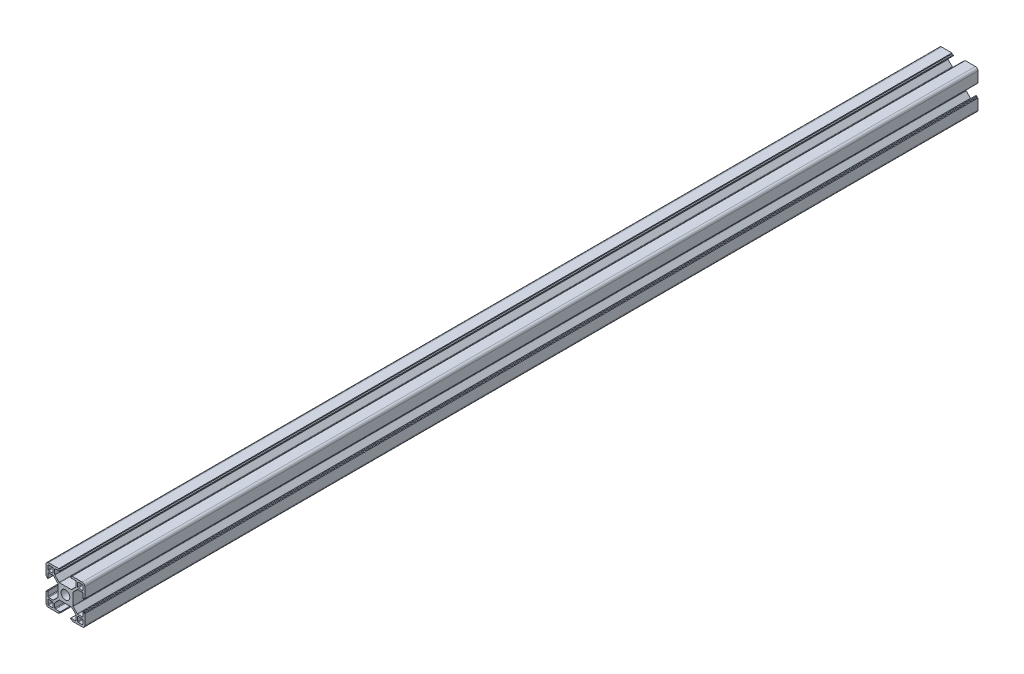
SolidWorks part; units mm, degrees
other "Body1"
ref_plane "Płaszczyzna przednia" through (0, 0, 0) normal (0, 0, 1) x (1, 0, 0)
ref_plane "Płaszczyzna górna" through (0, 0, 0) normal (0, 1, 0) x (1, 0, 0)
ref_plane "Płaszczyzna prawa" through (0, 0, 0) normal (1, 0, 0) x (0, 0, -1)
imported_body "Import1"
sketch "Szkic1" plane through (0, 0, 170) normal (0, 0, 1) x (1, 0, 0)
  line L4 (24.9798, 1.4394) -> (27.9798, 1.4394)
  line L5 (24.4798, 4.9394) -> (24.4798, 1.9394)
  line L6 (27.9798, 5.4394) -> (24.9798, 5.4394)
  line L7 (28.4798, 1.9394) -> (28.4798, 4.9394)
  line L8 (24.9798, 1.4394) -> (27.9798, 1.4394)
  line L9 (24.4798, 4.9394) -> (24.4798, 1.9394)
  line L10 (27.9798, 5.4394) -> (24.9798, 5.4394)
  line L11 (28.4798, 1.9394) -> (28.4798, 4.9394)
  line L12 (1.4798, 4.9394) -> (1.4798, 1.9394)
  line L13 (4.9798, 5.4394) -> (1.9798, 5.4394)
  line L14 (5.4798, 1.9394) -> (5.4798, 4.9394)
  line L15 (1.9798, 1.4394) -> (4.9798, 1.4394)
  line L16 (1.4798, 4.9394) -> (1.4798, 1.9394)
  line L17 (4.9798, 5.4394) -> (1.9798, 5.4394)
  line L18 (5.4798, 1.9394) -> (5.4798, 4.9394)
  line L19 (1.9798, 1.4394) -> (4.9798, 1.4394)
  line L20 (4.9798, 28.4394) -> (1.9798, 28.4394)
  line L21 (5.4798, 24.9394) -> (5.4798, 27.9394)
  line L22 (1.9798, 24.4394) -> (4.9798, 24.4394)
  line L23 (1.4798, 27.9394) -> (1.4798, 24.9394)
  line L24 (4.9798, 28.4394) -> (1.9798, 28.4394)
  line L25 (5.4798, 24.9394) -> (5.4798, 27.9394)
  line L26 (1.9798, 24.4394) -> (4.9798, 24.4394)
  line L27 (1.4798, 27.9394) -> (1.4798, 24.9394)
  line L28 (28.4798, 24.9394) -> (28.4798, 27.9394)
  line L29 (24.9798, 24.4394) -> (27.9798, 24.4394)
  line L30 (24.4798, 27.9394) -> (24.4798, 24.9394)
  line L31 (27.9798, 28.4394) -> (24.9798, 28.4394)
  line L32 (28.4798, 24.9394) -> (28.4798, 27.9394)
  line L33 (24.9798, 24.4394) -> (27.9798, 24.4394)
  line L34 (24.4798, 27.9394) -> (24.4798, 24.9394)
  line L35 (27.9798, 28.4394) -> (24.9798, 28.4394)
  line L60 (-0.0202, 9.8394) -> (-0.0202, 1.9394)
  line L61 (1.9798, -0.0606) -> (9.8798, -0.0606)
  line L62 (9.8798, -0.0606) -> (9.8798, 0.6894)
  line L63 (9.8798, 0.6894) -> (10.8798, 0.6894)
  line L64 (10.8798, 0.6894) -> (10.8798, 1.4394)
  line L65 (10.8798, 1.4394) -> (7.2298, 1.4394)
  line L66 (6.7298, 1.9394) -> (6.7298, 5.4216)
  line L67 (6.8762, 5.7752) -> (10.094, 8.9929)
  line L68 (10.4475, 9.1394) -> (19.512, 9.1394)
  line L69 (19.8656, 8.9929) -> (23.0833, 5.7752)
  line L70 (23.2298, 5.4216) -> (23.2298, 1.9394)
  line L71 (22.7298, 1.4394) -> (19.0798, 1.4394)
  line L72 (19.0798, 1.4394) -> (19.0798, 0.6894)
  line L73 (19.0798, 0.6894) -> (20.0798, 0.6894)
  line L74 (20.0798, 0.6894) -> (20.0798, -0.0606)
  line L75 (20.0798, -0.0606) -> (27.9798, -0.0606)
  line L76 (29.9798, 1.9394) -> (29.9798, 9.8394)
  line L77 (29.9798, 9.8394) -> (29.2298, 9.8394)
  line L78 (29.2298, 9.8394) -> (29.2298, 10.8394)
  line L79 (29.2298, 10.8394) -> (28.4798, 10.8394)
  line L80 (28.4798, 10.8394) -> (28.4798, 7.1894)
  line L81 (27.9798, 6.6894) -> (24.4975, 6.6894)
  line L82 (24.144, 6.8358) -> (20.9262, 10.0536)
  line L83 (20.7798, 10.4071) -> (20.7798, 19.4716)
  line L84 (20.9262, 19.8252) -> (24.144, 23.0429)
  line L85 (24.4975, 23.1894) -> (27.9798, 23.1894)
  line L86 (28.4798, 22.6894) -> (28.4798, 19.0394)
  line L87 (28.4798, 19.0394) -> (29.2298, 19.0394)
  line L88 (29.2298, 19.0394) -> (29.2298, 20.0394)
  line L89 (29.2298, 20.0394) -> (29.9798, 20.0394)
  line L90 (29.9798, 20.0394) -> (29.9798, 27.9394)
  line L91 (27.9798, 29.9394) -> (20.0798, 29.9394)
  line L92 (20.0798, 29.9394) -> (20.0798, 29.1894)
  line L93 (20.0798, 29.1894) -> (19.0798, 29.1894)
  line L94 (19.0798, 29.1894) -> (19.0798, 28.4394)
  line L95 (19.0798, 28.4394) -> (22.7298, 28.4394)
  line L96 (23.2298, 27.9394) -> (23.2298, 24.4571)
  line L97 (23.0833, 24.1036) -> (19.8656, 20.8858)
  line L98 (19.512, 20.7394) -> (10.4475, 20.7394)
  line L99 (10.094, 20.8858) -> (6.8762, 24.1036)
  line L100 (6.7298, 24.4571) -> (6.7298, 27.9394)
  line L101 (7.2298, 28.4394) -> (10.8798, 28.4394)
  line L102 (10.8798, 28.4394) -> (10.8798, 29.1894)
  line L103 (10.8798, 29.1894) -> (9.8798, 29.1894)
  line L104 (9.8798, 29.1894) -> (9.8798, 29.9394)
  line L105 (9.8798, 29.9394) -> (1.9798, 29.9394)
  line L106 (-0.0202, 27.9394) -> (-0.0202, 20.0394)
  line L107 (-0.0202, 20.0394) -> (0.7298, 20.0394)
  line L108 (0.7298, 20.0394) -> (0.7298, 19.0394)
  line L109 (0.7298, 19.0394) -> (1.4798, 19.0394)
  line L110 (1.4798, 19.0394) -> (1.4798, 22.6894)
  line L111 (1.9798, 23.1894) -> (5.462, 23.1894)
  line L112 (5.8156, 23.0429) -> (9.0333, 19.8252)
  line L113 (9.1798, 19.4716) -> (9.1798, 10.4071)
  line L114 (9.0333, 10.0536) -> (5.8156, 6.8358)
  line L115 (5.462, 6.6894) -> (1.9798, 6.6894)
  line L116 (1.4798, 7.1894) -> (1.4798, 10.8394)
  line L117 (1.4798, 10.8394) -> (0.7298, 10.8394)
  line L118 (0.7298, 10.8394) -> (0.7298, 9.8394)
  line L119 (0.7298, 9.8394) -> (-0.0202, 9.8394)
  line L120 (-0.0202, 9.8394) -> (-0.0202, 1.9394)
  line L121 (1.9798, -0.0606) -> (9.8798, -0.0606)
  line L122 (9.8798, -0.0606) -> (9.8798, 0.6894)
  line L123 (9.8798, 0.6894) -> (10.8798, 0.6894)
  line L124 (10.8798, 0.6894) -> (10.8798, 1.4394)
  line L125 (10.8798, 1.4394) -> (7.2298, 1.4394)
  line L126 (6.7298, 1.9394) -> (6.7298, 5.4216)
  line L127 (6.8762, 5.7752) -> (10.094, 8.9929)
  line L128 (10.4475, 9.1394) -> (19.512, 9.1394)
  line L129 (19.8656, 8.9929) -> (23.0833, 5.7752)
  line L130 (23.2298, 5.4216) -> (23.2298, 1.9394)
  line L131 (22.7298, 1.4394) -> (19.0798, 1.4394)
  line L132 (19.0798, 1.4394) -> (19.0798, 0.6894)
  line L133 (19.0798, 0.6894) -> (20.0798, 0.6894)
  line L134 (20.0798, 0.6894) -> (20.0798, -0.0606)
  line L135 (20.0798, -0.0606) -> (27.9798, -0.0606)
  line L136 (29.9798, 1.9394) -> (29.9798, 9.8394)
  line L137 (29.9798, 9.8394) -> (29.2298, 9.8394)
  line L138 (29.2298, 9.8394) -> (29.2298, 10.8394)
  line L139 (29.2298, 10.8394) -> (28.4798, 10.8394)
  line L140 (28.4798, 10.8394) -> (28.4798, 7.1894)
  line L141 (27.9798, 6.6894) -> (24.4975, 6.6894)
  line L142 (24.144, 6.8358) -> (20.9262, 10.0536)
  line L143 (20.7798, 10.4071) -> (20.7798, 19.4716)
  line L144 (20.9262, 19.8252) -> (24.144, 23.0429)
  line L145 (24.4975, 23.1894) -> (27.9798, 23.1894)
  line L146 (28.4798, 22.6894) -> (28.4798, 19.0394)
  line L147 (28.4798, 19.0394) -> (29.2298, 19.0394)
  line L148 (29.2298, 19.0394) -> (29.2298, 20.0394)
  line L149 (29.2298, 20.0394) -> (29.9798, 20.0394)
  line L150 (29.9798, 20.0394) -> (29.9798, 27.9394)
  line L151 (27.9798, 29.9394) -> (20.0798, 29.9394)
  line L152 (20.0798, 29.9394) -> (20.0798, 29.1894)
  line L153 (20.0798, 29.1894) -> (19.0798, 29.1894)
  line L154 (19.0798, 29.1894) -> (19.0798, 28.4394)
  line L155 (19.0798, 28.4394) -> (22.7298, 28.4394)
  line L156 (23.2298, 27.9394) -> (23.2298, 24.4571)
  line L157 (23.0833, 24.1036) -> (19.8656, 20.8858)
  line L158 (19.512, 20.7394) -> (10.4475, 20.7394)
  line L159 (10.094, 20.8858) -> (6.8762, 24.1036)
  line L160 (6.7298, 24.4571) -> (6.7298, 27.9394)
  line L161 (7.2298, 28.4394) -> (10.8798, 28.4394)
  line L162 (10.8798, 28.4394) -> (10.8798, 29.1894)
  line L163 (10.8798, 29.1894) -> (9.8798, 29.1894)
  line L164 (9.8798, 29.1894) -> (9.8798, 29.9394)
  line L165 (9.8798, 29.9394) -> (1.9798, 29.9394)
  line L166 (-0.0202, 27.9394) -> (-0.0202, 20.0394)
  line L167 (-0.0202, 20.0394) -> (0.7298, 20.0394)
  line L168 (0.7298, 20.0394) -> (0.7298, 19.0394)
  line L169 (0.7298, 19.0394) -> (1.4798, 19.0394)
  line L170 (1.4798, 19.0394) -> (1.4798, 22.6894)
  line L171 (1.9798, 23.1894) -> (5.462, 23.1894)
  line L172 (5.8156, 23.0429) -> (9.0333, 19.8252)
  line L173 (9.1798, 19.4716) -> (9.1798, 10.4071)
  line L174 (9.0333, 10.0536) -> (5.8156, 6.8358)
  line L175 (5.462, 6.6894) -> (1.9798, 6.6894)
  line L176 (1.4798, 7.1894) -> (1.4798, 10.8394)
  line L177 (1.4798, 10.8394) -> (0.7298, 10.8394)
  line L178 (0.7298, 10.8394) -> (0.7298, 9.8394)
  line L179 (0.7298, 9.8394) -> (-0.0202, 9.8394)
  circle A1 centre (14.9798, 14.9394) radius 3.4
  circle A2 centre (14.9798, 14.9394) radius 3.4
  arc A4 (27.9798, 1.4394) -> (28.4798, 1.9394) centre (27.9798, 1.9394) ccw
  arc A5 (24.4798, 1.9394) -> (24.9798, 1.4394) centre (24.9798, 1.9394) ccw
  arc A6 (24.9798, 5.4394) -> (24.4798, 4.9394) centre (24.9798, 4.9394) ccw
  arc A7 (28.4798, 4.9394) -> (27.9798, 5.4394) centre (27.9798, 4.9394) ccw
  arc A8 (27.9798, 1.4394) -> (28.4798, 1.9394) centre (27.9798, 1.9394) ccw
  arc A9 (24.4798, 1.9394) -> (24.9798, 1.4394) centre (24.9798, 1.9394) ccw
  arc A10 (24.9798, 5.4394) -> (24.4798, 4.9394) centre (24.9798, 4.9394) ccw
  arc A11 (28.4798, 4.9394) -> (27.9798, 5.4394) centre (27.9798, 4.9394) ccw
  arc A12 (1.4798, 1.9394) -> (1.9798, 1.4394) centre (1.9798, 1.9394) ccw
  arc A13 (1.9798, 5.4394) -> (1.4798, 4.9394) centre (1.9798, 4.9394) ccw
  arc A14 (5.4798, 4.9394) -> (4.9798, 5.4394) centre (4.9798, 4.9394) ccw
  arc A15 (4.9798, 1.4394) -> (5.4798, 1.9394) centre (4.9798, 1.9394) ccw
  arc A16 (1.4798, 1.9394) -> (1.9798, 1.4394) centre (1.9798, 1.9394) ccw
  arc A17 (1.9798, 5.4394) -> (1.4798, 4.9394) centre (1.9798, 4.9394) ccw
  arc A18 (5.4798, 4.9394) -> (4.9798, 5.4394) centre (4.9798, 4.9394) ccw
  arc A19 (4.9798, 1.4394) -> (5.4798, 1.9394) centre (4.9798, 1.9394) ccw
  arc A22 (1.9798, 28.4394) -> (1.4798, 27.9394) centre (1.9798, 27.9394) ccw
  arc A23 (5.4798, 27.9394) -> (4.9798, 28.4394) centre (4.9798, 27.9394) ccw
  arc A24 (4.9798, 24.4394) -> (5.4798, 24.9394) centre (4.9798, 24.9394) ccw
  arc A25 (1.4798, 24.9394) -> (1.9798, 24.4394) centre (1.9798, 24.9394) ccw
  arc A26 (1.9798, 28.4394) -> (1.4798, 27.9394) centre (1.9798, 27.9394) ccw
  arc A27 (5.4798, 27.9394) -> (4.9798, 28.4394) centre (4.9798, 27.9394) ccw
  arc A28 (-0.0202, 1.9394) -> (1.9798, -0.0606) centre (1.9798, 1.9394) ccw
  arc A29 (6.7298, 1.9394) -> (7.2298, 1.4394) centre (7.2298, 1.9394) ccw
  arc A30 (6.8762, 5.7752) -> (6.7298, 5.4216) centre (7.2298, 5.4216) ccw
  arc A31 (10.4475, 9.1394) -> (10.094, 8.9929) centre (10.4475, 8.6394) ccw
  arc A32 (19.8656, 8.9929) -> (19.512, 9.1394) centre (19.512, 8.6394) ccw
  arc A33 (23.2298, 5.4216) -> (23.0833, 5.7752) centre (22.7298, 5.4216) ccw
  arc A34 (22.7298, 1.4394) -> (23.2298, 1.9394) centre (22.7298, 1.9394) ccw
  arc A35 (27.9798, -0.0606) -> (29.9798, 1.9394) centre (27.9798, 1.9394) ccw
  arc A36 (27.9798, 6.6894) -> (28.4798, 7.1894) centre (27.9798, 7.1894) ccw
  arc A37 (24.144, 6.8358) -> (24.4975, 6.6894) centre (24.4975, 7.1894) ccw
  arc A38 (20.7798, 10.4071) -> (20.9262, 10.0536) centre (21.2798, 10.4071) ccw
  arc A39 (20.9262, 19.8252) -> (20.7798, 19.4716) centre (21.2798, 19.4716) ccw
  arc A40 (24.4975, 23.1894) -> (24.144, 23.0429) centre (24.4975, 22.6894) ccw
  arc A41 (28.4798, 22.6894) -> (27.9798, 23.1894) centre (27.9798, 22.6894) ccw
  arc A42 (29.9798, 27.9394) -> (27.9798, 29.9394) centre (27.9798, 27.9394) ccw
  arc A43 (23.2298, 27.9394) -> (22.7298, 28.4394) centre (22.7298, 27.9394) ccw
  arc A44 (23.0833, 24.1036) -> (23.2298, 24.4571) centre (22.7298, 24.4571) ccw
  arc A45 (19.512, 20.7394) -> (19.8656, 20.8858) centre (19.512, 21.2394) ccw
  arc A46 (10.094, 20.8858) -> (10.4475, 20.7394) centre (10.4475, 21.2394) ccw
  arc A47 (6.7298, 24.4571) -> (6.8762, 24.1036) centre (7.2298, 24.4571) ccw
  arc A48 (7.2298, 28.4394) -> (6.7298, 27.9394) centre (7.2298, 27.9394) ccw
  arc A49 (1.9798, 29.9394) -> (-0.0202, 27.9394) centre (1.9798, 27.9394) ccw
  arc A50 (1.9798, 23.1894) -> (1.4798, 22.6894) centre (1.9798, 22.6894) ccw
  arc A51 (5.8156, 23.0429) -> (5.462, 23.1894) centre (5.462, 22.6894) ccw
  arc A52 (9.1798, 19.4716) -> (9.0333, 19.8252) centre (8.6798, 19.4716) ccw
  arc A53 (9.0333, 10.0536) -> (9.1798, 10.4071) centre (8.6798, 10.4071) ccw
  arc A54 (5.462, 6.6894) -> (5.8156, 6.8358) centre (5.462, 7.1894) ccw
  arc A55 (1.4798, 7.1894) -> (1.9798, 6.6894) centre (1.9798, 7.1894) ccw
  arc A56 (-0.0202, 1.9394) -> (1.9798, -0.0606) centre (1.9798, 1.9394) ccw
  arc A57 (6.7298, 1.9394) -> (7.2298, 1.4394) centre (7.2298, 1.9394) ccw
  arc A58 (6.8762, 5.7752) -> (6.7298, 5.4216) centre (7.2298, 5.4216) ccw
  arc A59 (10.4475, 9.1394) -> (10.094, 8.9929) centre (10.4475, 8.6394) ccw
  arc A60 (19.8656, 8.9929) -> (19.512, 9.1394) centre (19.512, 8.6394) ccw
  arc A61 (23.2298, 5.4216) -> (23.0833, 5.7752) centre (22.7298, 5.4216) ccw
  arc A62 (22.7298, 1.4394) -> (23.2298, 1.9394) centre (22.7298, 1.9394) ccw
  arc A63 (27.9798, -0.0606) -> (29.9798, 1.9394) centre (27.9798, 1.9394) ccw
  arc A64 (27.9798, 6.6894) -> (28.4798, 7.1894) centre (27.9798, 7.1894) ccw
  arc A65 (24.144, 6.8358) -> (24.4975, 6.6894) centre (24.4975, 7.1894) ccw
  arc A66 (20.7798, 10.4071) -> (20.9262, 10.0536) centre (21.2798, 10.4071) ccw
  arc A67 (20.9262, 19.8252) -> (20.7798, 19.4716) centre (21.2798, 19.4716) ccw
  arc A68 (24.4975, 23.1894) -> (24.144, 23.0429) centre (24.4975, 22.6894) ccw
  arc A69 (28.4798, 22.6894) -> (27.9798, 23.1894) centre (27.9798, 22.6894) ccw
  arc A70 (29.9798, 27.9394) -> (27.9798, 29.9394) centre (27.9798, 27.9394) ccw
  arc A71 (23.2298, 27.9394) -> (22.7298, 28.4394) centre (22.7298, 27.9394) ccw
  arc A72 (23.0833, 24.1036) -> (23.2298, 24.4571) centre (22.7298, 24.4571) ccw
  arc A73 (19.512, 20.7394) -> (19.8656, 20.8858) centre (19.512, 21.2394) ccw
  arc A74 (10.094, 20.8858) -> (10.4475, 20.7394) centre (10.4475, 21.2394) ccw
  arc A75 (6.7298, 24.4571) -> (6.8762, 24.1036) centre (7.2298, 24.4571) ccw
  arc A76 (7.2298, 28.4394) -> (6.7298, 27.9394) centre (7.2298, 27.9394) ccw
  arc A77 (1.9798, 29.9394) -> (-0.0202, 27.9394) centre (1.9798, 27.9394) ccw
  arc A78 (1.9798, 23.1894) -> (1.4798, 22.6894) centre (1.9798, 22.6894) ccw
  arc A79 (5.8156, 23.0429) -> (5.462, 23.1894) centre (5.462, 22.6894) ccw
  arc A80 (9.1798, 19.4716) -> (9.0333, 19.8252) centre (8.6798, 19.4716) ccw
  arc A81 (9.0333, 10.0536) -> (9.1798, 10.4071) centre (8.6798, 10.4071) ccw
  arc A82 (5.462, 6.6894) -> (5.8156, 6.8358) centre (5.462, 7.1894) ccw
  arc A83 (1.4798, 7.1894) -> (1.9798, 6.6894) centre (1.9798, 7.1894) ccw
  arc A84 (4.9798, 24.4394) -> (5.4798, 24.9394) centre (4.9798, 24.9394) ccw
  arc A85 (1.4798, 24.9394) -> (1.9798, 24.4394) centre (1.9798, 24.9394) ccw
  arc A86 (28.4798, 27.9394) -> (27.9798, 28.4394) centre (27.9798, 27.9394) ccw
  arc A87 (27.9798, 24.4394) -> (28.4798, 24.9394) centre (27.9798, 24.9394) ccw
  arc A88 (24.4798, 24.9394) -> (24.9798, 24.4394) centre (24.9798, 24.9394) ccw
  arc A89 (24.9798, 28.4394) -> (24.4798, 27.9394) centre (24.9798, 27.9394) ccw
  arc A90 (28.4798, 27.9394) -> (27.9798, 28.4394) centre (27.9798, 27.9394) ccw
  arc A91 (27.9798, 24.4394) -> (28.4798, 24.9394) centre (27.9798, 24.9394) ccw
  arc A92 (24.4798, 24.9394) -> (24.9798, 24.4394) centre (24.9798, 24.9394) ccw
  arc A93 (24.9798, 28.4394) -> (24.4798, 27.9394) centre (24.9798, 27.9394) ccw
  dimension "D1" = 0
  dimension "D2" = 0
  dimension "D3" = 0
  dimension "D4" = 0
  dimension "D5" = 0
  dimension "D6" = 0
extrude "Dodanie-wyciągnięcie1" add sketch "Szkic1" along normal blind 350
